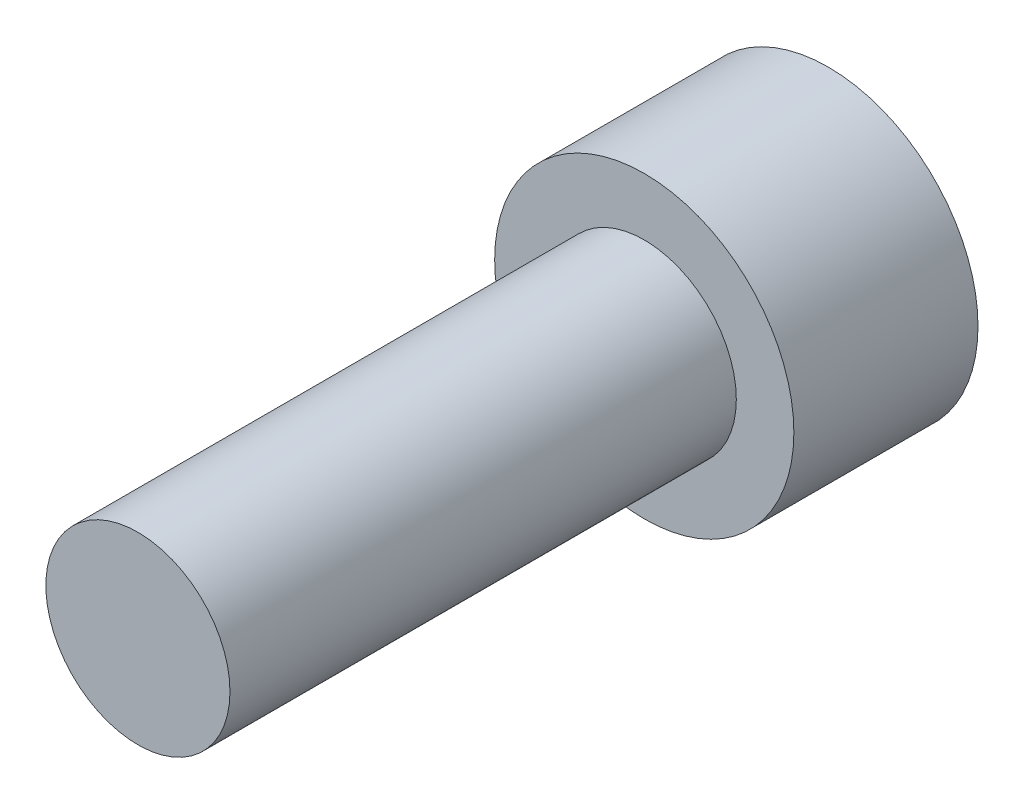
SolidWorks part; units mm, degrees
ref_plane "Front Plane" through (0, 0, 0) normal (0, 0, 1) x (1, 0, 0)
ref_plane "Top Plane" through (0, 0, 0) normal (0, 1, 0) x (1, 0, 0)
ref_plane "Right Plane" through (0, 0, 0) normal (1, 0, 0) x (0, 0, -1)
sketch "Sketch6" plane through (0, 0, 0) normal (1, 0, 0) x (0, 0, -1)
  line L0 (-22, 0) -> (22.525, 0) construction
  line L1 (7.15, 0) -> (-7.15, 0) construction
  line L2 (-22, 0) -> (-22, -4)
  line L3 (-22, -4) -> (0, -4)
  line L4 (0, 7.15) -> (0, -7.15) construction
  line L5 (0, -4) -> (0, -6.5)
  line L6 (0, -6.5) -> (8, -6.5)
  line L7 (8, -6.5) -> (8, 0)
  line L8 (8, 0) -> (-22, 0)
  dimension "L" = 22
  dimension "H" = 8
  dimension "A" = 13
  dimension "D" = 8
revolve "Revolve1" add sketch "Sketch6" angle 360 about L0
sketch "Sketch7" plane through (0, 0, -8) normal (0, 0, -1) x (-1, 0, 0)
  line L2 (-3, 1.7321) -> (-3, -1.7321)
  line L4 (-3, -1.7321) -> (0, -3.4641)
  line L5 (0, -3.4641) -> (3, -1.7321)
  line L6 (3, -1.7321) -> (3, 1.7321)
  line L7 (3, 1.7321) -> (0, 3.4641)
  line L8 (0, 3.4641) -> (-3, 1.7321)
  circle A0 centre (0, 0) radius 3 construction
  dimension "J" = 6
extrude "HEX" cut sketch "Sketch7" against normal blind 6
